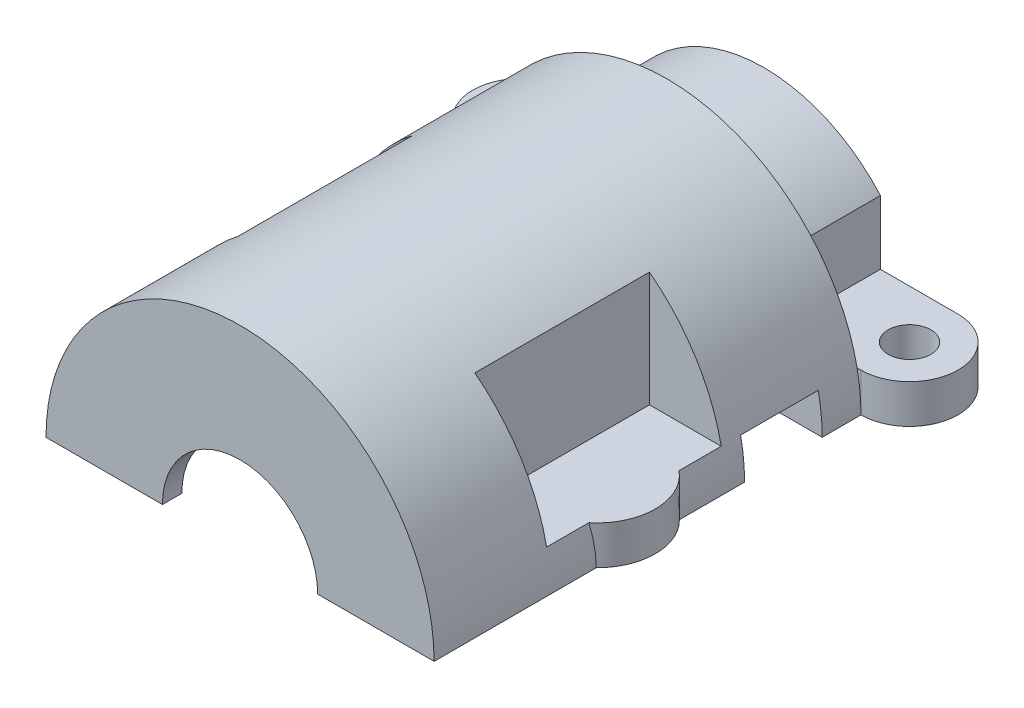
SolidWorks part; units mm, degrees
ref_plane "Front Plane" through (0, 0, 0) normal (0, 0, 1) x (1, 0, 0)
ref_plane "Top Plane" through (0, 0, 0) normal (0, 1, 0) x (1, 0, 0)
ref_plane "Right Plane" through (0, 0, 0) normal (1, 0, 0) x (0, 0, -1)
sketch "Sketch1" plane through (0, 0, 0) normal (0, 0, 1) x (1, 0, 0)
  circle A0 centre (0, 0) radius 12.7
  dimension "D1" = 25.4
extrude "Boss-Extrude1" add sketch "Sketch1" along normal blind 34.29
sketch "Sketch2" plane through (0, 0, 34.29) normal (0, 0, 1) x (1, 0, 0)
  line L1 (-12.7, 0) -> (12.7, 0)
  line L2 (-12.7, 0) -> (-12.7, -14.5535)
  line L3 (-12.7, -14.5535) -> (12.7, -14.5535)
  line L4 (12.7, 0) -> (12.7, -14.5535)
  circle A0 centre (0, 0) radius 12.7 construction
extrude "Cut-Extrude1" cut sketch "Sketch2" against normal through all
sketch "Sketch3" plane through (0, 0, 0) normal (0, -1, 0) x (1, 0, 0)
  line L0 (0, -2.0167) -> (0, 53.0196) construction
  line L1 (5.08, 34.29) -> (5.08, 33.02)
  line L2 (12.7, 34.29) -> (-12.7, 34.29) construction
  line L3 (5.08, 33.02) -> (7.9375, 33.02)
  line L4 (7.9375, 33.02) -> (7.9375, 27.94)
  line L5 (7.9375, 27.94) -> (5.207, 27.94)
  line L6 (5.207, 27.94) -> (5.207, 13.97)
  line L7 (5.207, 13.97) -> (9.525, 13.97)
  line L8 (9.525, 13.97) -> (9.525, 8.89)
  line L9 (9.525, 8.89) -> (8.128, 8.89)
  line L10 (8.128, 8.89) -> (8.128, 0)
  line L11 (12.7, 0) -> (-12.7, 0) construction
  line L12 (8.128, 0) -> (0, 0)
  line L13 (5.08, 34.29) -> (0, 34.29)
  line L14 (0, 0) -> (0, 34.29)
  point P7 (5.08, 33.655)
  dimension "D1" = 7.9375
  dimension "D2" = 5.08
  dimension "D3" = 5.207
  dimension "D4" = 1.27
  dimension "D5" = 5.08
  dimension "D6" = 13.97
  dimension "D7" = 5.08
  dimension "D8" = 9.525
  dimension "D9" = 8.128
revolve "Cut-Revolve1" cut sketch "Sketch3" angle 360 about L0
sketch "Sketch5" plane through (0, 0, 0) normal (0, -1, 0) x (-1, 0, 0)
  line L0 (5.08, -34.29) -> (12.7, -34.29) construction
  line L1 (14.2013, -26.67) -> (7.747, -26.67)
  line L2 (14.2013, -26.67) -> (14.2013, -15.24)
  line L3 (14.2013, -15.24) -> (7.747, -15.24)
  line L4 (7.747, -26.67) -> (7.747, -15.24)
  line L5 (9.525, -13.97) -> (5.207, -13.97) construction
  line L6 (5.207, -13.97) -> (5.207, -27.94) construction
  line L7 (0, -41.0612) -> (0, 2.7565) construction
  line L8 (-14.2013, -15.24) -> (-7.747, -15.24)
  line L9 (-7.747, -26.67) -> (-7.747, -15.24)
  line L10 (-14.2013, -26.67) -> (-7.747, -26.67)
  line L11 (-14.2013, -26.67) -> (-14.2013, -15.24)
  dimension "D1" = 7.62
  dimension "D2" = 1.27
  dimension "D3" = 2.54
extrude "Cut-Extrude2" cut sketch "Sketch5" against normal through all from offset 2.54
sketch "Sketch6" plane through (0, 0, 0) normal (1, 0, 0) x (0, 0, -1)
  line L0 (-8.89, 9.525) -> (-8.89, 0) construction
  line L1 (-13.97, 0) -> (-8.89, 0)
  line L2 (-13.97, 0) -> (-13.97, 2.54)
  line L3 (-13.97, 2.54) -> (-8.89, 2.54)
  line L4 (-8.89, 0) -> (-8.89, 2.54)
  dimension "D1" = 2.54
extrude "Cut-Extrude3" cut sketch "Sketch6" against normal through all both and the other way through all
sketch "Sketch7" plane through (0, 0, 0) normal (0, -1, 0) x (-1, 0, 0)
  line L0 (-9.1801, -8.89) -> (9.1801, -8.89) construction
  line L1 (-12.7, 0) -> (-6.35, 0)
  line L2 (-12.7, 0) -> (-12.7, -8.89)
  line L3 (-12.7, -8.89) -> (-6.35, -8.89)
  line L4 (-6.35, 0) -> (-6.35, -8.89)
  line L5 (0, 0) -> (0, -39.1785) construction
  line L6 (12.7, -8.89) -> (6.35, -8.89)
  line L7 (6.35, 0) -> (6.35, -8.89)
  line L8 (12.7, 0) -> (6.35, 0)
  line L9 (12.7, 0) -> (12.7, -8.89)
  dimension "D1" = 6.35
extrude "Boss-Extrude2" add sketch "Sketch7" against normal up to surface (5.0736 mm away)
sketch "Sketch8" plane through (0, 0, 0) normal (0, 0, -1) x (-1, 0, 0)
  line L0 (12.4434, 2.54) -> (9.8374, 2.54)
  line L1 (6.35, 0) -> (12.7, 0) construction
  line L2 (-9.8374, 2.54) -> (-12.4434, 2.54)
  arc A0 (9.8374, 2.54) -> (-9.8374, 2.54) centre (0, 0) ccw
  arc A2 (12.4434, 2.54) -> (-12.4434, 2.54) centre (0, 0) ccw
  dimension "D1" = 20.32
  dimension "D2" = 2.54
extrude "Cut-Extrude5" cut sketch "Sketch8" against normal blind 6.35
sketch "Sketch10" plane through (0, 0, 0) normal (0, 0, -1) x (-1, 0, 0)
  line L0 (-9.8374, 2.54) -> (-7.62, 2.54)
  line L1 (-7.62, 2.54) -> (-7.62, 7.6543)
  line L2 (-7.62, 7.6543) -> (-9.8374, 7.6543)
  line L3 (-9.8374, 7.6543) -> (-9.8374, 2.54)
  line L4 (-6.35, 5.0736) -> (-6.35, 0) construction
  line L5 (0, 0) -> (0, 14.5661) construction
  line L6 (7.62, 7.6543) -> (9.8374, 7.6543)
  line L7 (7.62, 2.54) -> (7.62, 7.6543)
  line L8 (9.8374, 2.54) -> (7.62, 2.54)
  line L9 (9.8374, 7.6543) -> (9.8374, 2.54)
  dimension "D1" = 1.27
extrude "Cut-Extrude6" cut sketch "Sketch10" against normal up to surface (6.35 mm away)
sketch "Sketch13" plane through (0, 2.54, 0) normal (0, 1, 0) x (1, 0, 0)
  line L0 (10.1506, -3.175) -> (12.4434, -3.175) construction
  line L1 (12.4434, -6.35) -> (12.4434, 0) construction
  line L2 (-12.7, -3.175) -> (-9.2105, -3.175) construction
  line L3 (-12.7, 0) -> (-9.2105, 0)
  line L4 (-12.7, -6.35) -> (-9.2105, -6.35)
  line L5 (-9.2105, 0) -> (-9.2105, -6.35)
  line L6 (10.1506, 0) -> (10.1506, -6.35)
  line L7 (10.1506, 0) -> (12.7, 0)
  line L8 (10.1506, -3.175) -> (12.7, -3.175) construction
  line L9 (10.1506, -6.35) -> (12.7, -6.35)
  arc A0 (-12.7, 0) -> (-12.7, -6.35) centre (-12.7, -3.175) ccw
  arc A1 (12.7, -6.35) -> (12.7, 0) centre (12.7, -3.175) ccw
  point P6 (0, -3.175)
  dimension "D1" = 6.35
  dimension "D2" = 25.4
extrude "Boss-Extrude4" add sketch "Sketch13" against normal up to surface (2.54 mm away)
sketch "Sketch14" plane through (0, 2.54, 0) normal (0, 1, 0) x (1, 0, 0)
  circle A0 centre (-12.7, -3.175) radius 1.397
  circle A1 centre (12.7, -3.175) radius 1.397
  dimension "D1" = 2.794
  dimension "D2" = 2.794
extrude "Cut-Extrude8" cut sketch "Sketch14" against normal through all
sketch "Sketch15" plane through (0, 2.54, 0) normal (0, 1, 0) x (1, 0, 0)
  line L1 (-7.747, -15.24) -> (-7.747, -26.67) construction
  line L4 (-7.747, -26.67) -> (-12.4434, -26.67) construction
  line L5 (0, 0) -> (0, -36.5481) construction
  line L6 (7.62, 0) -> (-7.62, 0) construction
  circle A0 centre (-10.033, -20.955) radius 1.397
  circle A1 centre (10.033, -20.955) radius 1.397
  dimension "D3" = 2.794
  dimension "D1" = 2.286
  dimension "D2" = 5.715
sketch "Sketch17" plane through (0, 2.54, 0) normal (0, 1, 0) x (1, 0, 0)
  line L0 (0, -34.29) -> (0, 0) construction
  line L1 (-12.7, -34.29) -> (12.7, -34.29) construction
  circle A0 centre (-10.033, -20.955) radius 3.81
  circle A1 centre (10.033, -20.955) radius 3.81
  dimension "D1" = 7.62
extrude "Boss-Extrude5" add sketch "Sketch17" against normal up to surface (2.54 mm away)
